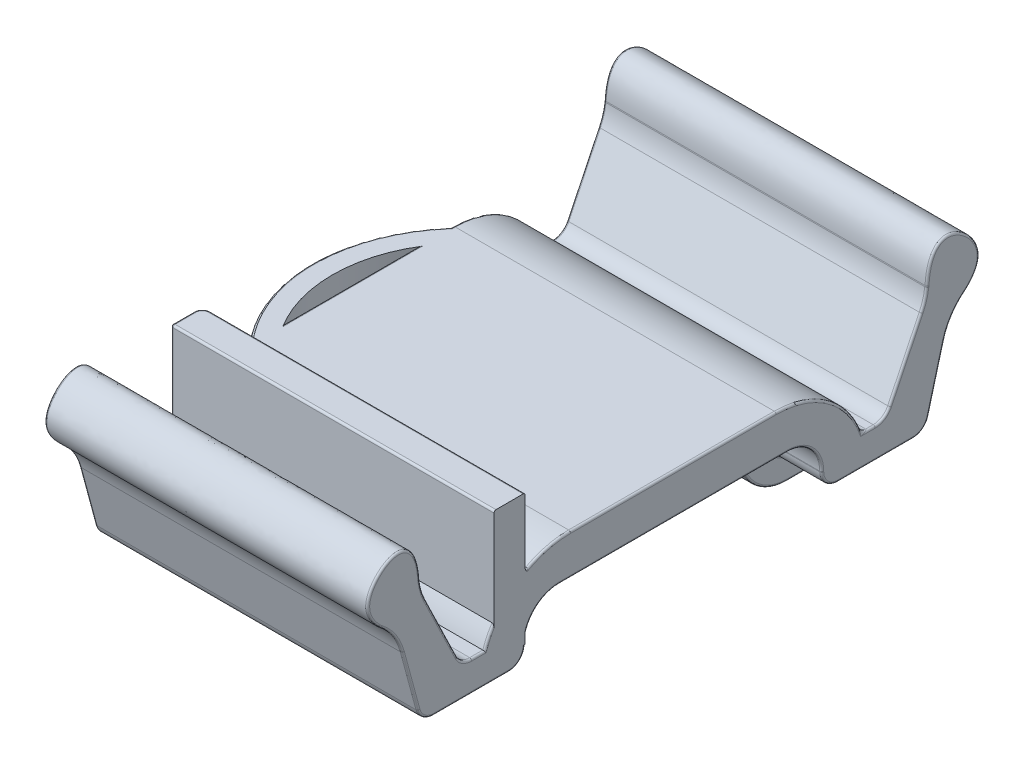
SolidWorks part; units mm, degrees
ref_plane "Front" through (0, 0, 0) normal (0, 0, 1) x (1, 0, 0)
ref_plane "Top" through (0, 0, 0) normal (0, 1, 0) x (1, 0, 0)
ref_plane "Right" through (0, 0, 0) normal (1, 0, 0) x (0, 0, -1)
sketch "Эскиз1" plane through (0, 0, 0) normal (1, 0, 0) x (0, 0, -1)
  line L0 (0, -27.2516) -> (0, 27.2516) construction
  line L1 (7.35, 0) -> (-7.35, 0)
  line L2 (7.35, 0) -> (7.35, -2.53)
  line L3 (7.35, -2.53) -> (12.5, -2.53)
  line L6 (10.5, -1.03) -> (9.35, -1.03)
  line L7 (9.35, -1.03) -> (9.35, 2)
  line L8 (9.35, 2) -> (-9.35, 2)
  line L9 (-9.35, -1.03) -> (-9.35, 2)
  line L10 (-10.5, -1.03) -> (-9.35, -1.03)
  line L13 (-7.35, -2.53) -> (-12.5, -2.53)
  line L14 (-7.35, 0) -> (-7.35, -2.53)
  line L15 (-12.5, -2.53) -> (-13.7964, 2.2709)
  line L17 (10.5, -1.03) -> (12.5692, 3.256)
  line L18 (12.5, -2.53) -> (13.7964, 2.2709)
  line L19 (-10.5, -1.03) -> (-12.5692, 3.256)
  arc A4 (-12.5692, 3.256) -> (-13.7964, 2.2709) centre (-13.75, 3.47) ccw
  arc A5 (12.5692, 3.256) -> (13.7964, 2.2709) centre (13.75, 3.47) cw
  point P4 (0, 0)
  point P8 (0, 0)
  point P25 (0, 2)
  point P30 (0, 0)
  dimension "D3" = 27.5
  dimension "D9" = 6
  dimension "D10" = 1.2
  dimension "D1" = 2.53
  dimension "D2" = 25
  dimension "D4" = 14.7
  dimension "D5" = 2
  dimension "D6" = 1.5
  dimension "D7" = 2
  dimension "D8" = 2
extrude "Бобышка-Вытянуть1" add sketch "Эскиз1" along normal mid plane 16
fillet "Скругление1" radius 1.7 2 edges at (0, 0, -7.35) (0, 0, 7.35)
fillet "Скругление3" radius 4.5 2 edges at (0, 2, -9.35) (0, 2, 9.35)
fillet "Скругление7" radius 3 4 edges at (0, 2.2709, -13.7964) (0, 3.256, -12.5692) (0, 3.256, 12.5692) (0, 2.2709, 13.7964)
sketch "Эскиз2" plane through (8, 0, 0) normal (1, 0, 0) x (0, 0, -1)
  line L0 (-14.6077, 2.6308) -> (-12.5653, 3.661)
  line L1 (0, 7.7658) -> (0, -7.7658) construction
  line L2 (14.6077, 2.6308) -> (12.5653, 3.661)
  arc A0 (-12.5583, 3.6107) -> (-14.4881, 2.5239) centre (-13.75, 3.47) ccw construction
  arc A1 (14.4881, 2.5239) -> (12.5583, 3.6107) centre (13.75, 3.47) ccw construction
  arc A2 (-12.5583, 3.6107) -> (-12.2806, 2.658) centre (-9.579, 3.9624) ccw construction
  spline S0 degree 3 poles (-14.6077, 2.6308) (-15.1054, 3.1394) (-15.5788, 4.758) (-12.7315, 6.3885) (-12.5653, 3.661) knots 0 0 0 0 0.289496 1 1 1 1
  spline S1 degree 3 poles (14.6077, 2.6308) (15.1054, 3.1394) (15.5788, 4.758) (12.7315, 6.3885) (12.5653, 3.661) knots 0 0 0 0 0.289496 1 1 1 1
  point P14 (0, 0)
extrude "Бобышка-Вытянуть2" add sketch "Эскиз2" against normal up to surface (16 mm away)
fillet "Скругление8" radius 0.8 6 edges at (0, -1.03, -10.5) (0, -1.03, 10.5) (0, -2.53, -12.5) (0, -2.53, -7.35) (0, -2.53, 7.35) (0, -2.53, 12.5)
fillet "Скругление10" radius 0.1 64 edges at (8, 1.8176, -13.834) (-8, 1.8176, -13.834) (-8, 2.5753, -14.5497) (8, 2.5753, -14.5497) (8, 3.6359, -12.5615) (-8, 3.6359, -12.5615) (8, 3.1228, -12.4591) (-8, 3.1228, -12.4591) (-8, 1.0401, -11.4994) (8, 1.0401, -11.4994) (8, -0.9076, -10.4232) (-8, -0.9076, -10.4232) (8, 1.165, -7.7079) (-8, 1.165, -7.7079) (8, 2, 0) (-8, 2, 0) (8, 1.165, 7.7079) (-8, 1.165, 7.7079) (8, -0.9076, 10.4232) (-8, -0.9076, 10.4232) (8, 1.0401, 11.4994) (-8, 1.0401, 11.4994) (8, 3.1228, 12.4591) (-8, 3.1228, 12.4591) (-8, 3.6359, 12.5615) (8, 3.6359, 12.5615) (-8, 2.5753, 14.5497) (8, 2.5753, 14.5497) (8, 1.8176, 13.834) (-8, 1.8176, 13.834) (-8, -0.499, 13.0484) (8, -0.499, 13.0484) (8, -2.3652, 12.3738) (-8, -2.3652, 12.3738) (-8, -2.53, 10.0187) (8, -2.53, 10.0187) (8, -2.2957, 7.5843) (-8, -2.2957, 7.5843) (8, -1.715, 7.35) (-8, -1.715, 7.35) (8, -0.4979, 6.8521) (-8, -0.4979, 6.8521) (-8, 0, 0) (8, 0, 0) (8, -0.4979, -6.8521) (-8, -0.4979, -6.8521) (-8, -1.715, -7.35) (8, -1.715, -7.35) (8, -2.2957, -7.5843) (-8, -2.2957, -7.5843) (-8, -2.53, -10.0187) (8, -2.53, -10.0187) (8, -2.3652, -12.3738) (-8, -2.3652, -12.3738) (8, -0.499, -13.0484) (-8, -0.499, -13.0484) (8, -1.03, -9.6739) (-8, -1.03, -9.6739) (-8, -1.03, 9.6739) (8, -1.03, 9.6739)
ref_plane "Плоскость1" through (0.5, 0, 0) normal (-1, 0, 0) x (0, 0, 1)
sketch "Эскиз3" plane through (0.5, 0, 0) normal (-1, 0, 0) x (0, 0, 1)
  line L0 (-8.15, -2.53) -> (-11, -2.53)
  line L16 (-11.8874, -2.53) -> (-8.15, -2.53) construction
  line L17 (-7.35, -1.73) -> (-7.35, -1.7) construction
  line L18 (-7.35, -1.73) -> (-7.35, -1.7)
  line L19 (7.35, -1.7) -> (7.35, -1.73) construction
  line L20 (7.35, -1.7) -> (7.35, -1.73)
  line L28 (-5.65, 0) -> (5.65, 0) construction
  line L30 (8.15, -2.53) -> (11.8874, -2.53) construction
  line L36 (-11, -3.73) -> (-8.1231, -3.73)
  line L38 (-4.8727, -1) -> (4.85, -1)
  line L40 (8.15, -3.73) -> (11, -3.73)
  line L43 (-5.65, 0) -> (5.65, 0)
  line L45 (8.15, -2.53) -> (11, -2.53)
  line L46 (11, -3.73) -> (11, -2.53)
  line L47 (-11, -3.73) -> (-11, -2.53)
  arc A20 (-8.15, -2.53) -> (-7.35, -1.73) centre (-8.15, -1.73) ccw construction
  arc A23 (7.35, -1.73) -> (8.15, -2.53) centre (8.15, -1.73) ccw construction
  arc A24 (-5.65, 0) -> (-7.35, -1.7) centre (-5.65, -1.7) ccw construction
  arc A25 (-5.65, 0) -> (-7.35, -1.7) centre (-5.65, -1.7) ccw
  arc A26 (7.35, -1.7) -> (5.65, 0) centre (5.65, -1.7) ccw construction
  arc A28 (-8.1231, -3.73) -> (-5.8577, -1.8273) centre (-8.1231, -1.43) ccw
  arc A29 (-4.8727, -1) -> (-5.8577, -1.8273) centre (-4.8727, -2) ccw
  arc A30 (5.85, -2) -> (4.85, -1) centre (4.85, -2) ccw
  arc A31 (5.85, -2) -> (8.15, -3.73) centre (8.0785, -1.4311) ccw
  arc A32 (-8.15, -2.53) -> (-7.35, -1.73) centre (-8.15, -1.73) ccw
  arc A35 (7.35, -1.73) -> (8.15, -2.53) centre (8.15, -1.73) ccw
  arc A36 (7.35, -1.7) -> (5.65, 0) centre (5.65, -1.7) ccw
  point P3 (0, -6.3553)
  dimension "D5" = 2.3
  dimension "D6" = 1
  dimension "D8" = 1.4923
  dimension "D1" = 22
  dimension "D3" = 11
  dimension "D2" = 1.2
  dimension "D4" = 1.2
  dimension "D7" = 1
extrude "Бобышка-Вытянуть3" add sketch "Эскиз3" against normal blind 5
fillet "Скругление11" radius 0.25 4 edges at (5.5, -3.13, 11) (0.5, -3.13, 11) (5.5, -3.13, -11) (0.5, -3.13, -11)
fillet "Скругление13" radius 0.1 13 edges at (0.5, -1.2343, -5.5159) (0.5, -3.1912, -6.6439) (0.5, -3.73, -9.4366) (0.5732, -3.73, -10.9268) (3, -3.73, -11) (5.4268, -3.73, -10.9268) (5.5, -3.73, -9.4366) (5.5, -3.1912, -6.6439) (5.5, -1.2343, -5.5159) (5.5, -1, -0.0114) (5.5, -1.2929, 5.5571) (0.5, -1.2929, 5.5571) (0.5, -1, -0.0114)
sketch "Эскиз5" plane through (-8, 0, 0) normal (-1, 0, 0) x (0, 0, 1)
  line L0 (7.35, -1.73) -> (7.35, 4.77)
  line L1 (7.35, 4.77) -> (8.8938, 4.77)
  line L2 (8.8938, 4.77) -> (8.8938, -1.8287)
  line L3 (11.8874, -2.53) -> (8.15, -2.53) construction
  line L4 (8.8938, -1.8287) -> (7.35, -1.73)
  dimension "D1" = 7.3
extrude "Бобышка-Вытянуть5" add sketch "Эскиз5" against normal up to surface (16 mm away)
fillet "Скругление15" radius 0.1 6 edges at (-8, 2.2467, 8.8938) (-7.95, -1.73, 7.35) (-7.8779, -0.857, 7.35) (-7.9771, -0.153, 8.8938) (-8, -1.7332, 7.4) (-8, -1.4192, 7.35)
fillet "Скругление16" radius 0.1 7 edges at (-8, 4.77, 8.0719) (-7.9707, 4.77, 8.8645) (7.9773, 1.353, 7.35) (-7.9669, 1.3657, 7.35) (0.05, 4.77, 8.8938) (0, 4.77, 7.35) (0, 1.3953, 7.35)
sketch "Эскиз6" plane through (0, 2, 0) normal (0, 1, 0) x (1, 0, 0)
  line L1 (-8, -5.0969) -> (-8, 5.0969) construction
  line L2 (-7.9, 5.0969) -> (-7.1669, 4.4168)
  line L3 (-7.9, -5.0969) -> (-7.1669, -4.4168)
  arc A0 (-7.9, -5.0969) -> (-7.9, 5.0969) centre (-2.4055, 0) cw
  arc A1 (-7.1669, -4.4168) -> (-7.1669, 4.4168) centre (-2.4055, 0) cw
  point P8 (-9.9, 0)
  dimension "D1" = 1.9
  dimension "D2" = 1
extrude "Бобышка-Вытянуть6" add sketch "Эскиз6" against normal up to surface (2 mm away)
fillet "Скругление17" radius 0.1 2 edges at (-9.9, 2, 0) (-9.9, 0, 0)
fillet "Скругление18" radius 0.1 6 edges at (-7.9804, 0.0406, 4.9794) (-7.9804, 0.0406, -4.9794) (-7.9804, 1.9594, -4.9794) (-7.9804, 1.9594, 4.9794) (-8, 1, -4.9869) (-8, 1, 4.9869)
fillet "Скругление19" radius 0.4 6 edges at (7.9539, -1.0457, -9.3388) (-7.9539, -1.0457, -9.3388) (0, -1.03, -9.35) (-7.9707, 4.7407, 7.3793) (-8, 1.4846, 7.3419) (-8, 3.1023, 7.35)
sketch "Эскиз7" plane through (0, -1, 0) normal (0, -1, 0) x (1, 0, 0)
  line L0 (0.5, -4.8727) -> (0.5, 4.85) construction
  circle A0 centre (0.5, -0.0114) radius 3.5
  dimension "D1" = 7
extrude "Бобышка-Вытянуть7" add sketch "Эскиз7" against normal up to surface (1 mm away)
fillet "Скругление20" radius 0.1 28 edges at (-3, -1, -0.0114) (0.5, -0.4979, 6.8521) (0.5, -1.715, 7.35) (0.5, -2.2957, 7.5843) (0.5, -2.53, 9.45) (0.5732, -2.53, 10.9268) (3, -2.53, 11) (5.4268, -2.53, 10.9268) (5.5, -2.53, 9.45) (5.5, -2.2957, 7.5843) (5.5, -1.715, 7.35) (5.5, -0.4979, 6.8521) (5.5, 0, 0) (5.5, -0.4979, -6.8521) (5.5, -1.715, -7.35) (5.5, -2.2957, -7.5843) (5.5, -2.53, -9.45) (5.4268, -2.53, -10.9268) (3, -2.53, -11) (0.5732, -2.53, -10.9268) (0.5, -2.53, -9.45) (0.5, -2.2957, -7.5843) (0.5, -1.715, -7.35) (0.5, -0.4979, -6.8521) (-8.9, 0, 0) (0.5, 0, 4.5693) (-3, 0, -0.0114) (0.5, 0, -4.5807)
